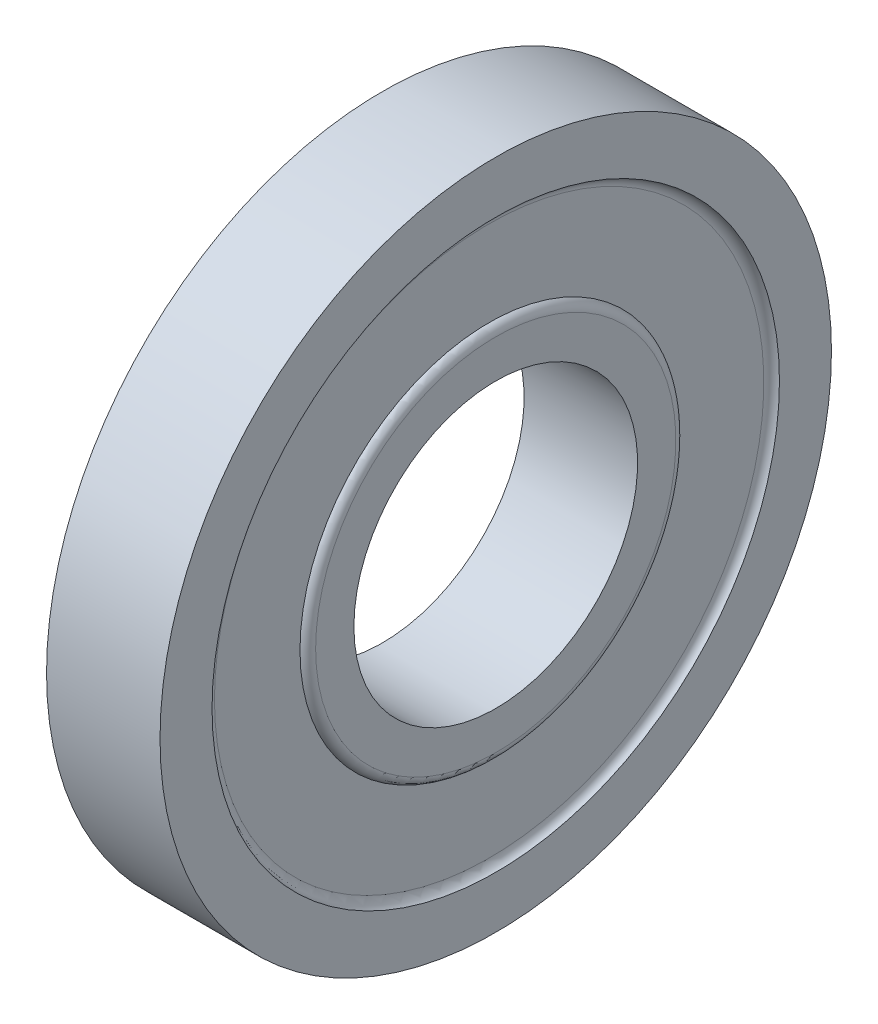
SolidWorks part; units mm, degrees
ref_plane "Front Plane" through (0, 0, 0) normal (0, 0, 1) x (1, 0, 0)
ref_plane "Top Plane" through (0, 0, 0) normal (0, 1, 0) x (1, 0, 0)
ref_plane "Right Plane" through (0, 0, 0) normal (1, 0, 0) x (0, 0, -1)
sketch "Sketch3" plane through (0, 0, 0) normal (0, 0, 1) x (1, 0, 0)
  line L0 (-14.5406, 0) -> (16.0536, 0) construction
  line L1 (6, 15) -> (-6, 15)
  line L2 (-6, 15) -> (-6, 20)
  line L3 (-6, 20) -> (-5.3, 20)
  line L4 (-5.3, 20) -> (-5.3, 30)
  line L5 (-5.3, 30) -> (-6, 30)
  line L6 (-6, 30) -> (-6, 35.5)
  line L7 (-6, 35.5) -> (6, 35.5)
  line L9 (6, 30) -> (6, 35.5)
  line L10 (5.3, 30) -> (6, 30)
  line L11 (5.3, 20) -> (5.3, 30)
  line L12 (6, 20) -> (5.3, 20)
  line L13 (6, 15) -> (6, 20)
  line L14 (0, 15) -> (0, 0) construction
  point P11 (5.65, 20)
  point P17 (-5.65, 20)
  dimension "D1" = 15
  dimension "D2" = 35.5
  dimension "D3" = 20
  dimension "D4" = 30
  dimension "D5" = 12
  dimension "D6" = 12
  dimension "D7" = 10.6
revolve "Revolve1" add sketch "Sketch3" angle 360 about L0
fillet "Fillet1" radius 1 4 edges at (6, 0, 20) (5.3, 0, 30) (-5.3, 0, 30) (-6, 0, 20)
